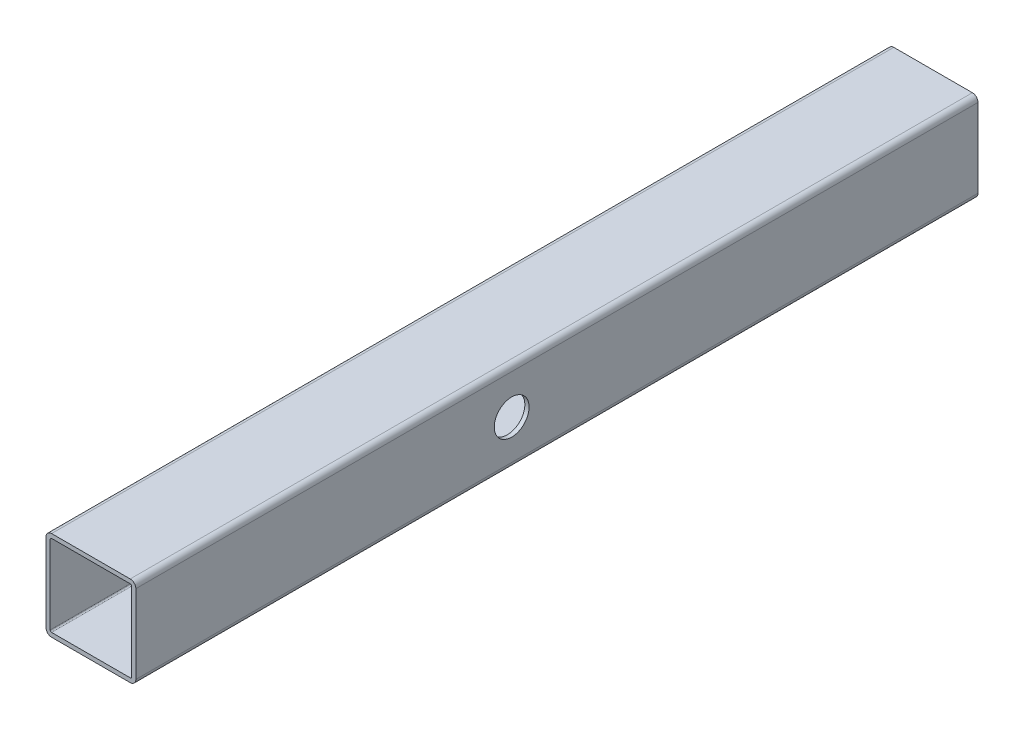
SolidWorks part; units mm, degrees
ref_plane "Front" through (0, 0, 0) normal (0, 0, 1) x (1, 0, 0)
ref_plane "Top" through (0, 0, 0) normal (0, 1, 0) x (1, 0, 0)
ref_plane "Right" through (0, 0, 0) normal (1, 0, 0) x (0, 0, -1)
sketch "Sketch1" plane through (0, 0, 0) normal (0, 0, 1) x (1, 0, 0)
  line L0 (-44.45, 46.0375) -> (44.45, 46.0375)
  line L1 (-44.45, 50.8) -> (44.45, 50.8)
  line L2 (-50.8, 44.45) -> (-50.8, -44.45)
  line L3 (-44.45, -50.8) -> (44.45, -50.8)
  line L4 (50.8, 44.45) -> (50.8, -44.45)
  line L5 (46.0375, 44.45) -> (46.0375, -44.45)
  line L6 (-44.45, -46.0375) -> (44.45, -46.0375)
  line L7 (-46.0375, 44.45) -> (-46.0375, -44.45)
  arc A0 (-50.8, 44.45) -> (-44.45, 50.8) centre (-44.45, 44.45) cw
  arc A1 (50.8, 44.45) -> (44.45, 50.8) centre (44.45, 44.45) ccw
  arc A2 (44.45, -50.8) -> (50.8, -44.45) centre (44.45, -44.45) ccw
  arc A3 (-44.45, -50.8) -> (-50.8, -44.45) centre (-44.45, -44.45) cw
  arc A4 (46.0375, 44.45) -> (44.45, 46.0375) centre (44.45, 44.45) ccw
  arc A5 (44.45, -46.0375) -> (46.0375, -44.45) centre (44.45, -44.45) ccw
  arc A6 (-44.45, -46.0375) -> (-46.0375, -44.45) centre (-44.45, -44.45) cw
  arc A7 (-46.0375, 44.45) -> (-44.45, 46.0375) centre (-44.45, 44.45) cw
  point P7 (-50.8, 50.8)
  point P12 (50.8, -50.8)
  point P15 (-50.8, -50.8)
  dimension "D5" = 6.35
  dimension "D1" = 50.8
  dimension "D2" = 50.8
  dimension "D3" = 101.6
  dimension "D4" = 101.6
  dimension "D6" = 4.7625
extrude "Extrude1" add sketch "Sketch1" along normal mid plane 952.5
sketch "Sketch2" plane through (-50.8, 0, 0) normal (-1, 0, 0) x (0, 0, 1)
  line L0 (-476.25, 0) -> (476.25, 0) construction
  line L1 (-476.25, 44.45) -> (-476.25, -44.45) construction
  line L2 (476.25, 44.45) -> (476.25, -44.45) construction
  line L3 (51.181, 0) -> (51.181, -44.45) construction
  line L4 (476.25, -44.45) -> (-476.25, -44.45) construction
  circle A0 centre (51.181, 0) radius 19.685
  dimension "D2" = 39.37
  dimension "D1" = 527.431
extrude "Cut-Extrude1" cut sketch "Sketch2" against normal through all
